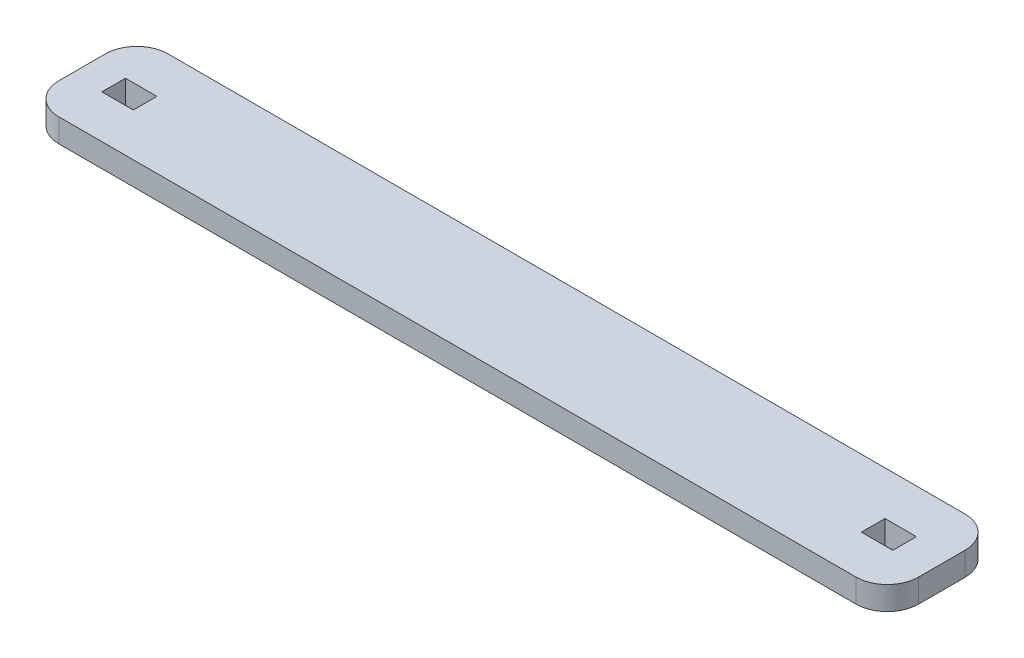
SolidWorks part; units mm, degrees
ref_plane "Front Plane" through (0, 0, 0) normal (0, 0, 1) x (1, 0, 0)
ref_plane "Top Plane" through (0, 0, 0) normal (0, 1, 0) x (1, 0, 0)
ref_plane "Right Plane" through (0, 0, 0) normal (1, 0, 0) x (0, 0, -1)
sketch "Sketch1" plane through (0, 0, 0) normal (0, 1, 0) x (1, 0, 0)
  line L1 (-239.5238, 48.8095) -> (270.4762, 48.8095)
  line L2 (-259.5238, 28.8095) -> (-259.5238, -0.9905)
  line L3 (-239.5238, -20.9905) -> (270.4762, -20.9905)
  line L4 (290.4762, 28.8095) -> (290.4762, -0.9905)
  line L5 (-239.6107, 21.7145) -> (-219.5107, 21.7145)
  line L6 (-239.6107, 21.7145) -> (-239.6107, 6.6145)
  line L7 (-239.6107, 6.6145) -> (-219.5107, 6.6145)
  line L8 (-219.5107, 21.7145) -> (-219.5107, 6.6145)
  line L9 (247.2852, 20.7145) -> (267.3852, 20.7145)
  line L10 (247.2852, 20.7145) -> (247.2852, 5.6145)
  line L11 (247.2852, 5.6145) -> (267.3852, 5.6145)
  line L12 (267.3852, 20.7145) -> (267.3852, 5.6145)
  arc A0 (270.4762, 48.8095) -> (290.4762, 28.8095) centre (270.4762, 28.8095) cw
  arc A1 (270.4762, -20.9905) -> (290.4762, -0.9905) centre (270.4762, -0.9905) ccw
  arc A2 (-259.5238, -0.9905) -> (-239.5238, -20.9905) centre (-239.5238, -0.9905) ccw
  arc A3 (-239.5238, 48.8095) -> (-259.5238, 28.8095) centre (-239.5238, 28.8095) ccw
  point P6 (290.4762, 48.8095)
  point P9 (290.4762, -20.9905)
  point P14 (-259.5238, 48.8095)
  dimension "D3" = 20
  dimension "D4" = 20
  dimension "D5" = 20
  dimension "D6" = 20
  dimension "D1" = 550
  dimension "D2" = 69.8
  dimension "D7" = 15.1
  dimension "D8" = 20.1
  dimension "D9" = 15.1
  dimension "D10" = 20.1
extrude "respaldos" add sketch "Sketch1" along normal mid plane 15
